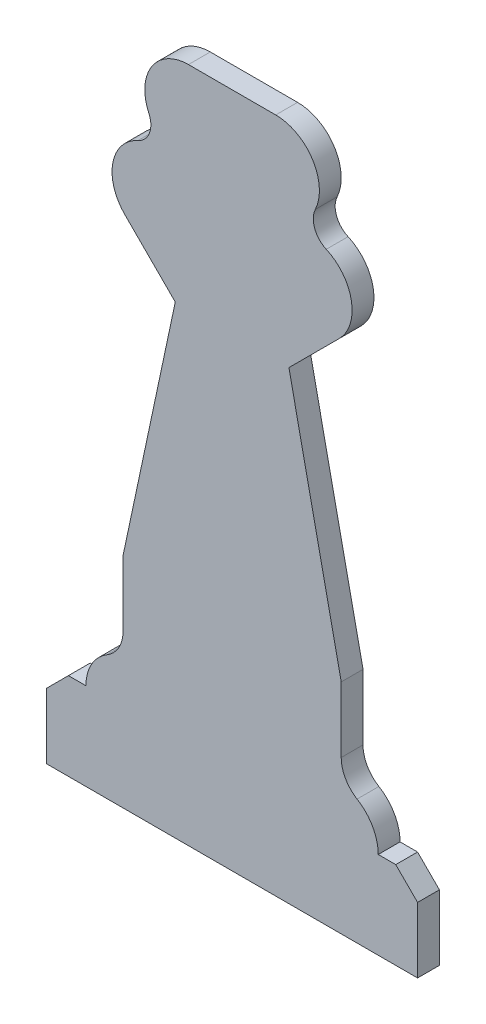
SolidWorks part; units mm, degrees
ref_plane "Alzado" through (0, 0, 0) normal (0, 0, 1) x (1, 0, 0)
ref_plane "Planta" through (0, 0, 0) normal (0, 1, 0) x (1, 0, 0)
ref_plane "Vista lateral" through (0, 0, 0) normal (1, 0, 0) x (0, 0, -1)
sketch "Peon" plane through (0, 0, 0) normal (0, 0, 1) x (1, 0, 0)
  line L0 (0, 0) -> (0, 63.5) construction
  line L1 (-17, 0) -> (17, 0)
  line L2 (17, 0) -> (17, 6)
  line L3 (10, 20) -> (5.2069, 42.55)
  line L4 (9.8284, 47.1716) -> (5.2069, 42.55)
  line L5 (4, 62) -> (-4, 62)
  line L6 (15, 8) -> (13.3944, 8)
  line L7 (10, 14) -> (10, 20)
  line L9 (15, 8) -> (17, 6)
  line L10 (-15, 8) -> (-17, 6)
  line L11 (-10, 14) -> (-10, 20)
  line L12 (-15, 8) -> (-13.3944, 8)
  line L13 (-9.8284, 47.1716) -> (-5.2069, 42.55)
  line L14 (-10, 20) -> (-5.2069, 42.55)
  line L15 (-17, 0) -> (-17, 6)
  arc A0 (13.3944, 8) -> (11.4548, 11.4286) centre (9.3944, 8) ccw
  arc A1 (11.4548, 11.4286) -> (10, 14) centre (13, 14) cw
  arc A2 (7.6299, 56.3195) -> (8.6299, 53.6529) centre (9.4448, 55.4793) ccw
  arc A3 (-7.6299, 56.3195) -> (-4, 62) centre (-4, 58) cw
  arc A4 (-9.8284, 47.1716) -> (-8.6299, 53.6529) centre (-7, 50) cw
  arc A5 (9.8284, 47.1716) -> (8.6299, 53.6529) centre (7, 50) ccw
  arc A6 (-7.6299, 56.3195) -> (-8.6299, 53.6529) centre (-9.4448, 55.4793) cw
  arc A7 (7.6299, 56.3195) -> (4, 62) centre (4, 58) ccw
  arc A8 (-11.4548, 11.4286) -> (-10, 14) centre (-13, 14) ccw
  arc A9 (-13.3944, 8) -> (-11.4548, 11.4286) centre (-9.3944, 8) cw
  point P37 (0, 62)
  point P39 (0, 0)
  dimension "D2" = 34
  dimension "D3" = 8
  dimension "D5" = 4
  dimension "D6" = 3
  dimension "D7" = 14
  dimension "D10" = 4
  dimension "D11" = 12
  dimension "D13" = 14
  dimension "D14" = 2
  dimension "D4" = 20
  dimension "D12" = 4
  dimension "D15" = 12
  dimension "D1" = 62
  dimension "D8" = 20
  dimension "D9" = 8
  dimension "D16" = 45
  dimension "D17" = 45
  dimension "D18" = 2
extrude "Saliente-Extruir1" add sketch "Peon" along normal blind 2
